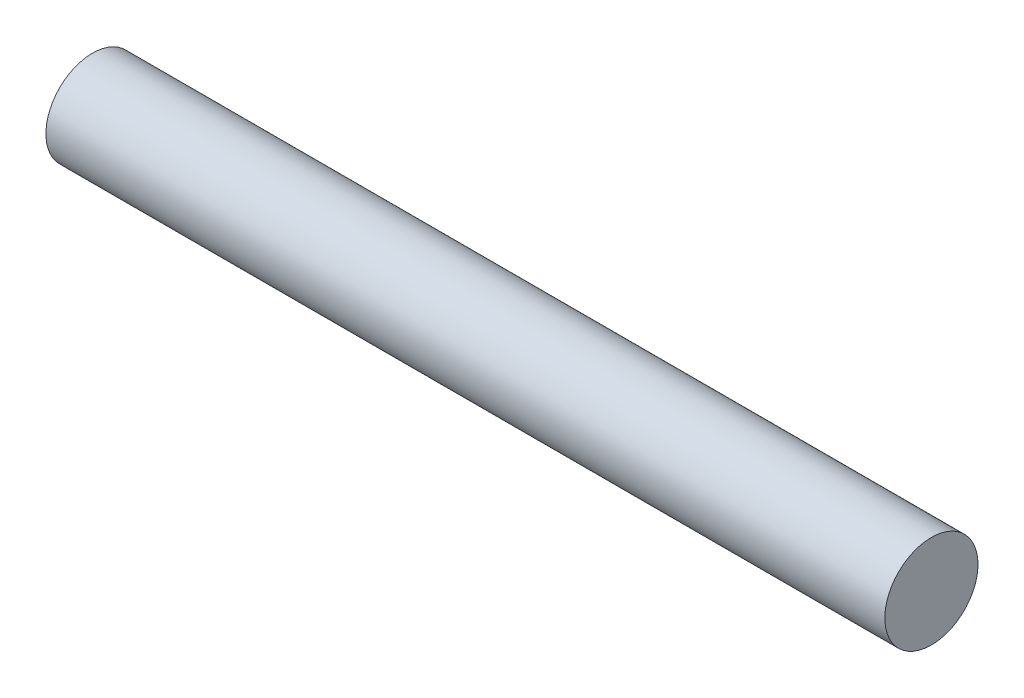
SolidWorks part; units mm, degrees
ref_plane "Alzado" through (0, 0, 0) normal (0, 0, 1) x (1, 0, 0)
ref_plane "Planta" through (0, 0, 0) normal (0, 1, 0) x (1, 0, 0)
ref_plane "Vista lateral" through (0, 0, 0) normal (1, 0, 0) x (0, 0, -1)
sketch "Croquis1" plane through (0, 0, 0) normal (1, 0, 0) x (0, 0, -1)
  circle A0 centre (0, 0) radius 1
  dimension "D1" = 2
extrude "Saliente-Extruir1" add sketch "Croquis1" along normal blind 18
